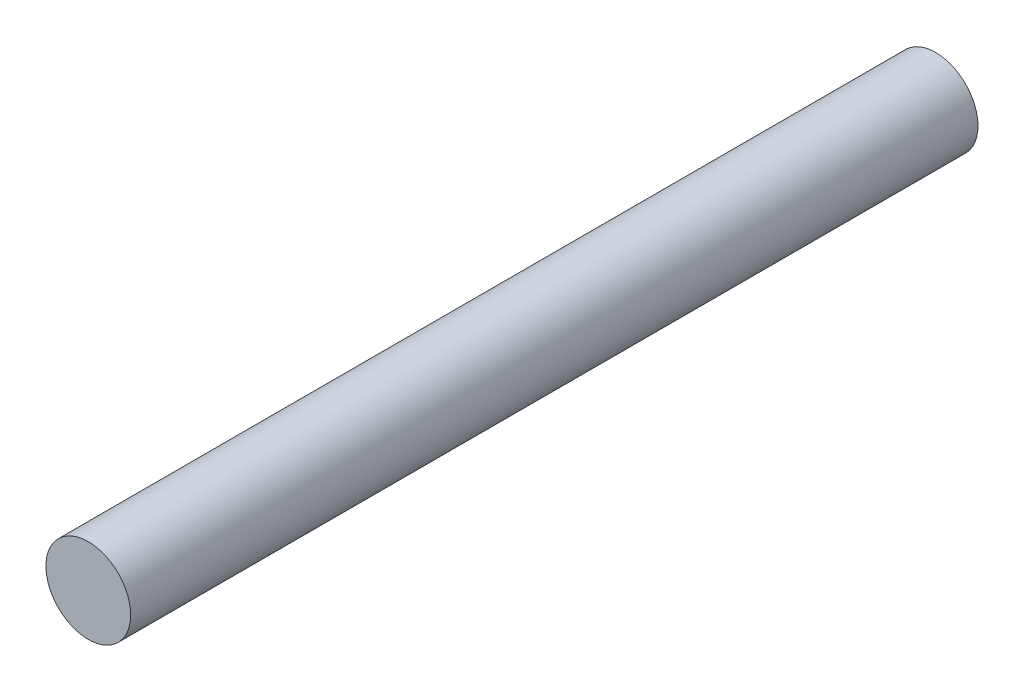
SolidWorks part; units mm, degrees
ref_plane "Front Plane" through (0, 0, 0) normal (0, 0, 1) x (1, 0, 0)
ref_plane "Top Plane" through (0, 0, 0) normal (0, 1, 0) x (1, 0, 0)
ref_plane "Right Plane" through (0, 0, 0) normal (1, 0, 0) x (0, 0, -1)
sketch "Sketch1" plane through (0, 0, 0) normal (0, 0, 1) x (1, 0, 0)
  circle A0 centre (0, 0) radius 12.7
  dimension "D1" = 25.4
extrude "Boss-Extrude1" add sketch "Sketch1" along normal blind 254
